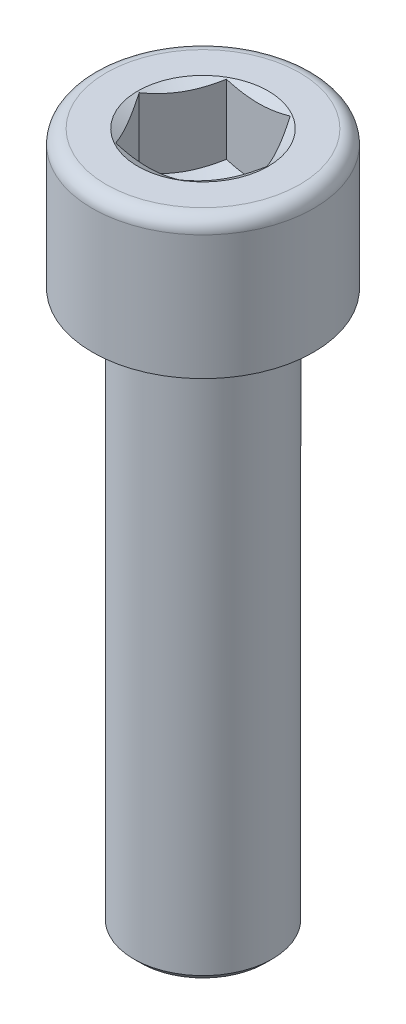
SolidWorks part; units mm, degrees
ref_plane "Ebene1" through (0, 0, 0) normal (0, 0, 1) x (1, 0, 0)
ref_plane "Ebene2" through (0, 0, 0) normal (0, 1, 0) x (1, 0, 0)
ref_plane "Ebene3" through (0, 0, 0) normal (1, 0, 0) x (0, 0, -1)
sketch "Skizze2" plane through (0, 0, 0) normal (0, 1, 0) x (1, 0, 0)
  circle A0 centre (0, 0) radius 8
  dimension "D1" = 16
extrude "Schraubenkopf" add sketch "Skizze2" along normal blind 10
sketch "Skizze3" plane through (0, 0, 0) normal (0, -1, 0) x (1, 0, 0)
  circle A0 centre (0, 0) radius 5
  dimension "D1" = 10
extrude "Schraubenschaft" add sketch "Skizze3" along normal blind 40
sketch "Skizze4" plane through (0, 0, 0) normal (0, 0, 1) x (1, 0, 0)
  line L0 (4.75, 10) -> (4.75, 5)
  line L1 (8, 10) -> (-8, 10) construction
  line L2 (4.75, 5) -> (0, 2.2576)
  line L3 (0, 10) -> (0, 0) construction
  line L4 (0, 7.0657) -> (0, -1.3786) construction
  line L5 (4.75, 10) -> (0, 10)
  line L6 (0, 2.2576) -> (0, 10)
  dimension "D1" = 9.5
  dimension "D2" = 5
  dimension "D3" = 60
revolve "Kegelform Innensechskant" cut sketch "Skizze4" angle 360 about L4
sketch "Skizze5" plane through (0, 0, 0) normal (0, 1, 0) x (1, 0, 0)
  line L0 (0, 0) -> (3.3492, 0) construction
  line L1 (2.3094, -4) -> (4.6188, 0)
  line L2 (4.6188, 0) -> (2.3094, 4)
  line L3 (2.3094, 4) -> (-2.3094, 4)
  line L4 (-2.3094, 4) -> (-4.6188, 0)
  line L5 (-4.6188, 0) -> (-2.3094, -4)
  line L6 (-2.3094, -4) -> (2.3094, -4)
  circle A0 centre (0, 0) radius 4 construction
  circle A1 centre (0, 0) radius 4.75 construction
  circle A2 centre (0, 0) radius 4.75
  dimension "D1" = 8
extrude "Innensechskant" add sketch "Skizze5" along normal up to surface (10 mm away)
sketch "Skizze6" plane through (0, 0, 0) normal (0, 0, 1) x (1, 0, 0)
  line L0 (2.3094, 10) -> (4.6188, 10) construction
  line L1 (3.7188, 10) -> (4.7188, 10)
  line L2 (4.7188, 10) -> (3.7188, 9.4226)
  line L3 (3.7188, 9.4226) -> (3.7188, 10)
  line L4 (4.6188, 10) -> (4.6188, 4.9243) construction
  line L5 (0, 0) -> (0, 10) construction
  line L6 (-2.3094, 10) -> (2.3094, 10) construction
  dimension "D1" = 0.1
  dimension "D2" = 1
  dimension "D3" = 30
revolve "Fase Innensechskant" cut sketch "Skizze6" angle 360 about L5
sketch "Skizze7" plane through (0, 0, 0) normal (0, 0, 1) x (1, 0, 0)
  line L0 (5, -40) -> (5, 0) construction
  line L1 (5, -0.01) -> (5, 0.01)
  line L2 (5, 0.01) -> (4.99, 0)
  line L3 (4.99, 0) -> (5, -0.01)
  line L4 (4.99, 0) -> (5, 0) construction
  line L5 (-5, -40) -> (5, -40) construction
  line L6 (0, 0) -> (0, -40) construction
  dimension "D1" = 90
  dimension "D2" = 0.01
revolve "Sichtbereich Gewindelänge" cut sketch "Skizze7" angle 360 about L6
chamfer "Fase 0,5x45°" distance 0.5 angle 45 1 edges at (0, -40, -5)
fillet "R 0,4" radius 0.4 1 edges at (0, 0, 5)
fillet "R 1" radius 1 1 edges at (0, 10, 8)
